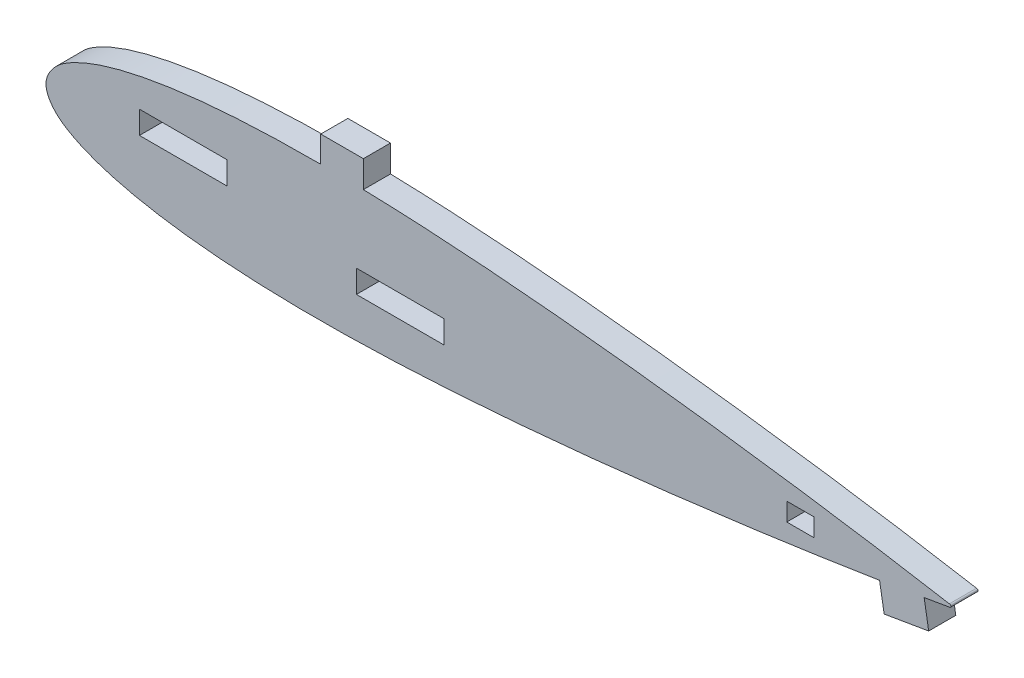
SolidWorks part; units mm, degrees
ref_plane "Alzado" through (0, 0, 0) normal (0, 0, 1) x (1, 0, 0)
ref_plane "Planta" through (0, 0, 0) normal (0, 1, 0) x (1, 0, 0)
ref_plane "Vista lateral" through (0, 0, 0) normal (1, 0, 0) x (0, 0, -1)
sketch "Croquis1" plane through (0, 0, 0) normal (0, 0, 1) x (1, 0, 0)
  line L0 (92.2719, -1.452) -> (92.7791, -4.4331)
  line L1 (92.7791, -4.4331) -> (97.7083, -3.5946)
  line L2 (97.7083, -3.5946) -> (97.2051, -0.637)
  arc A1 (100, 0.158) -> (100, -0.158) centre (100.0082, 0) cw
  spline S0 degree 3 poles (97.2051, -0.637) (98.137, -0.4785) (99.0685, -0.3183) (100, -0.158) knots 0.986199 0.986199 0.986199 0.986199 1 1 1 1
  spline S2 degree 3 poles (100, 0.158) (98.3339, 0.4446) (95.0042, 1.0175) (88.341, 2.0824) (80.0114, 3.305) (70.0105, 4.6075) (60.0106, 5.7373) (50.0107, 6.6607) (40.0091, 7.3168) (31.6676, 7.5477) (24.9972, 7.4567) (19.9916, 7.2094) (14.9791, 6.7334) (10.8061, 6.0669) (7.4734, 5.2745) (4.943, 4.4799) (2.8157, 3.5154) (0.9062, 2.2392) (-0.5751, 0) (0.9062, -2.2392) (2.8157, -3.5154) (4.943, -4.4799) (7.4734, -5.2745) (10.8061, -6.0669) (14.9791, -6.7334) (19.9916, -7.2094) (24.9972, -7.4567) (31.6676, -7.5477) (40.0091, -7.3168) (50.0107, -6.6607) (60.0106, -5.7373) (70.0105, -4.6075) (80.0114, -3.305) (87.4294, -2.2162) (91.5149, -1.573) (92.2719, -1.452) knots 0 0 0 0 0.024684 0.04933 0.098522 0.147602 0.196578 0.24545 0.294219 0.342904 0.367241 0.391608 0.416059 0.440726 0.453243 0.466028 0.479473 0.486972 0.5 0.513028 0.520527 0.533972 0.546757 0.559274 0.583941 0.608392 0.632759 0.657096 0.705781 0.75455 0.803422 0.852398 0.901478 0.95067 0.961864 0.961864 0.961864 0.961864
extrude "Saliente-Extruir1" add sketch "Croquis1" along normal blind 3 contours S2 L0 L1 L2 S0 A1
sketch "Croquis2" plane through (0, 0, 3) normal (0, 0, 1) x (1, 0, 0)
  line L0 (81.9997, 1) -> (84.9997, 1)
  line L5 (81.9997, 1) -> (81.9997, -1)
  line L6 (81.9997, -1) -> (84.9997, -1)
  line L7 (84.9997, 1) -> (84.9997, -1)
  line L8 (0, -9.298) -> (100, -9.298) construction
  line L9 (17.3333, 4.5) -> (37.3333, 4.5) construction
  line L10 (17.3333, 4.5) -> (17.3333, -4.5) construction
  line L11 (17.3333, -4.5) -> (37.3333, -4.5) construction
  line L12 (37.3333, 4.5) -> (37.3333, -4.5) construction
  line L30 (10.3433, 2.75) -> (20.0633, 2.75)
  line L31 (10.3433, 2.75) -> (10.3433, 0.23)
  line L32 (10.3433, 0.23) -> (20.0633, 0.23)
  line L33 (20.0633, 2.75) -> (20.0633, 0.23)
  line L34 (34.3633, -0.48) -> (44.0833, -0.48)
  line L35 (34.3633, -0.48) -> (34.3633, -3)
  line L36 (34.3633, -3) -> (44.0833, -3)
  line L37 (44.0833, -0.48) -> (44.0833, -3)
  arc A0 (100, -0.158) -> (100, 0.158) centre (100.0082, 0) ccw construction
  point P7 (83.4997, 1)
  point P11 (100.1664, 0)
  point P17 (27.3333, 4.5)
extrude "Cortar-Extruir1" cut sketch "Croquis2" against normal blind 3
sketch "Croquis3" plane through (0, 0, 3) normal (0, 0, 1) x (1, 0, 0)
  line L0 (17.3333, 4.5) -> (37.3333, 4.5) construction
  line L1 (30.4133, 10.4) -> (35.1333, 10.4)
  line L2 (30.4133, 10.4) -> (30.4133, 7.4)
  line L3 (30.4133, 7.4) -> (35.1333, 7.4)
  line L4 (35.1333, 10.4) -> (35.1333, 7.4)
  line L5 (37.3333, 4.5) -> (37.3333, -4.5) construction
extrude "Saliente-Extruir2" add sketch "Croquis3" against normal blind 3
equation "\"mat\"=3"
equation "\"D1@Croquis1\"=\"mat\""
equation "\"D1@Saliente-Extruir1\"=\"mat\""
equation "\"D2@Croquis2\"=\"mat\""
equation "\"leng\"=2"
equation "\"D1@Croquis2\"=\"leng\""
equation "\"D3@Croquis2\"=\"leng\"/2"
equation "\"escala\"=100"
equation "\"D4@Croquis2\"=\"escala\""
equation "\"D5@Croquis2\"=\"escala\"/6"
equation "\"pla1\"=20"
equation "\"D6@Croquis2\"=\"pla1\""
equation "\"pla2\"=9"
equation "\"D7@Croquis2\"=\"pla2\""
equation "\"D8@Croquis2\"=\"pla2\"/2"
equation "\"D12@Croquis2\"=6+(2*\"escala\"/3)"
equation "\"kerf\"= .24"
equation "\"D9@Croquis2\"=\"mat\"-(2*\"kerf\")"
equation "\"D16@Croquis2\"=\"mat\"-(2*\"kerf\")"
equation "\"D3@Croquis3\"=\"mat\""
